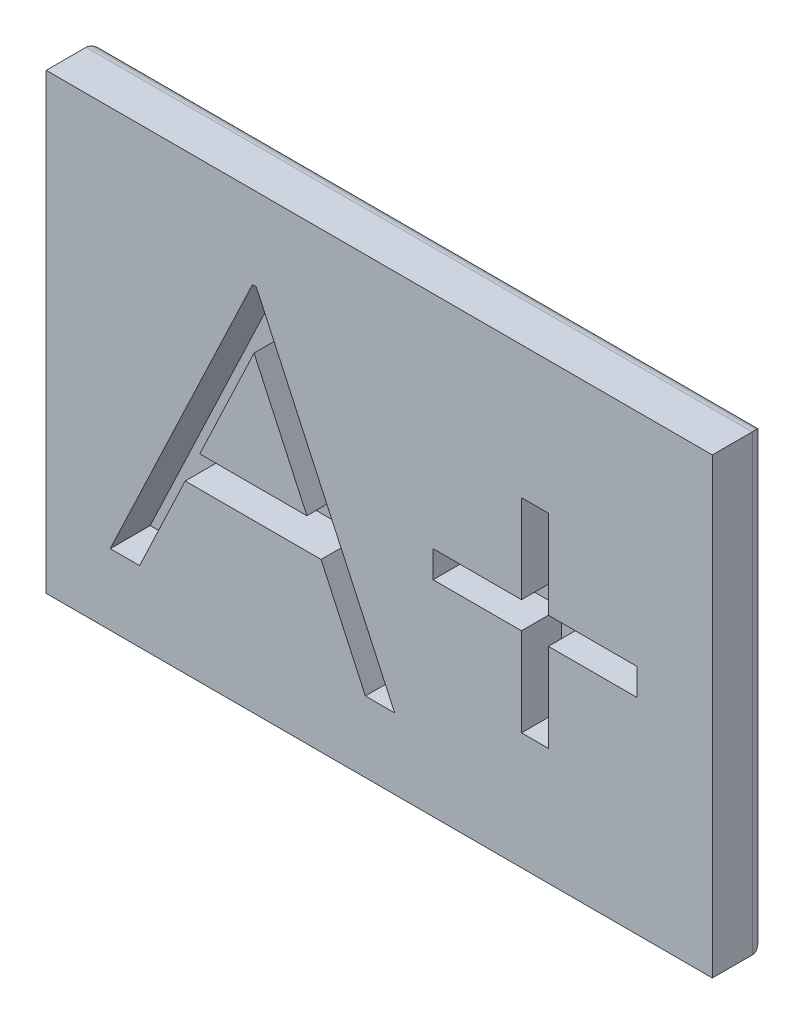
SolidWorks part; units mm, degrees
ref_plane "Front Plane" through (0, 0, 0) normal (0, 0, 1) x (1, 0, 0)
ref_plane "Top Plane" through (0, 0, 0) normal (0, 1, 0) x (1, 0, 0)
ref_plane "Right Plane" through (0, 0, 0) normal (1, 0, 0) x (0, 0, -1)
sketch "Sketch1" plane through (0, 0, 0) normal (0, 0, 1) x (1, 0, 0)
  line L1 (-15.875, -10.795) -> (15.875, -10.795)
  line L2 (-15.875, -10.795) -> (-15.875, 10.795)
  line L3 (-15.875, 10.795) -> (15.875, 10.795)
  line L4 (15.875, -10.795) -> (15.875, 10.795)
  line L5 (-15.875, -10.795) -> (15.875, 10.795) construction
  line L6 (-15.875, 10.795) -> (15.875, -10.795) construction
  point P0 (0, 0)
  dimension "D1" = 31.75
  dimension "D2" = 21.59
extrude "Boss-Extrude1" add sketch "Sketch1" along normal blind 2.54
fillet "Fillet1" radius 0.635 4 edges at (-15.875, 0, 0) (0, -10.795, 0) (0, 10.795, 0) (15.875, 0, 0)
sketch "Sketch2" plane through (0, 0, 2.54) normal (0, 0, 1) x (1, 0, 0)
  line L0 (-15.875, 10.795) -> (-14.977, 9.897) construction
  line L2 (-14.977, 9.897) -> (-14.977, 4.9485) construction
  line L3 (-14.977, 4.9485) -> (-14.977, 0) construction
  line L4 (-14.977, 0) -> (-14.977, -4.9485) construction
  line L5 (-14.977, -4.9485) -> (-14.977, -9.897) construction
  line L6 (-14.977, -9.897) -> (-15.875, -10.795) construction
  line L7 (15.875, 10.795) -> (-15.875, 10.795) construction
  line L8 (-15.875, -10.795) -> (15.875, -10.795) construction
  line L9 (-14.977, 4.9485) -> (14.977, 4.9485) construction
  line L10 (14.977, 4.9485) -> (14.977, 0) construction
  line L11 (14.977, 0) -> (-14.977, 0) construction
  line L12 (14.977, 0) -> (14.977, -4.9485) construction
  line L13 (14.977, -4.9485) -> (-14.977, -4.9485) construction
  line L14 (-14.977, -9.897) -> (14.977, -9.897) construction
  line L15 (14.977, -9.897) -> (14.977, -4.9485) construction
  line L16 (-14.977, 9.897) -> (14.977, 9.897) construction
  line L17 (14.977, 9.897) -> (14.977, 4.9485) construction
  line L18 (14.977, 9.897) -> (15.875, 10.795) construction
  line L19 (14.977, -9.897) -> (15.875, -10.795) construction
  line L20 (-14.977, -7.4227) -> (14.977, -7.4227) construction
  text T0 "A+" font "Century Gothic" height 14.2875
  dimension "D1" = 45
  dimension "D2" = 45
  dimension "D3" = 1.27
extrude "Cut-Extrude1" cut sketch "Sketch2" against normal blind 1.905
